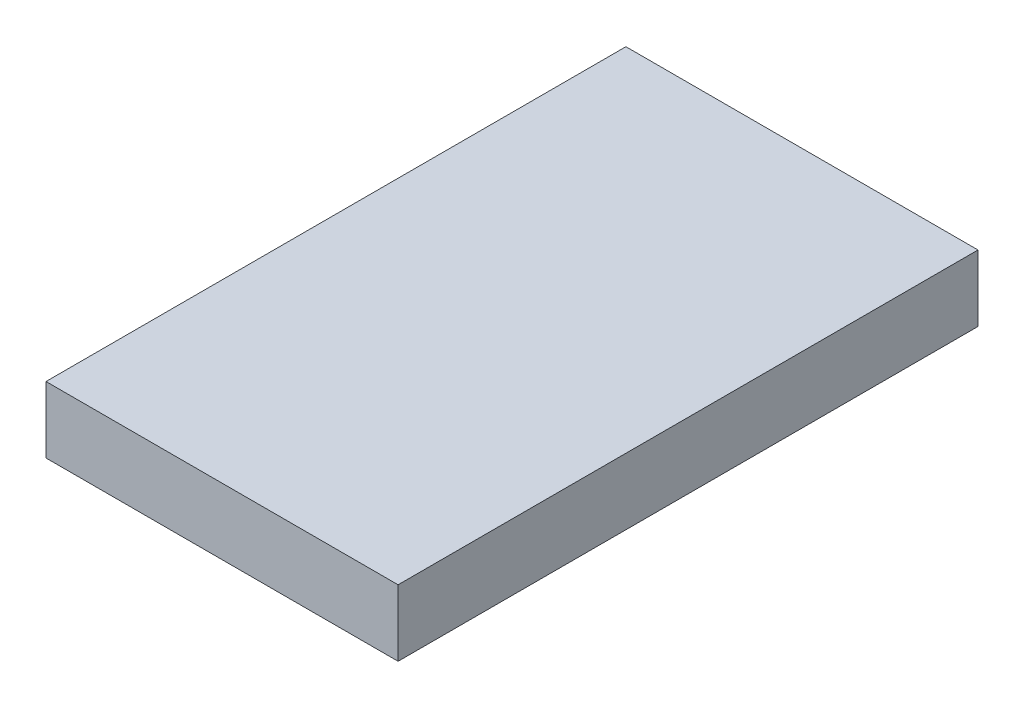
SolidWorks part; units mm, degrees
ref_plane "前视基准面" through (0, 0, 0) normal (0, 0, 1) x (1, 0, 0)
ref_plane "上视基准面" through (0, 0, 0) normal (0, 1, 0) x (1, 0, 0)
ref_plane "右视基准面" through (0, 0, 0) normal (1, 0, 0) x (0, 0, -1)
sketch "草图1" plane through (0, 0, 0) normal (0, 0, 1) x (1, 0, 0)
  line L0 (0, 0) -> (0, 16)
  line L1 (0, 16) -> (-85, 16)
  line L2 (-85, 16) -> (-85, 0)
  line L3 (-85, 0) -> (0, 0)
  dimension "D1" = 85
  dimension "D2" = 16
extrude "凸台-拉伸2" add sketch "草图1" along normal mid plane 140
ref_plane "基准面1" through (-14, 0, 0) normal (1, 0, 0) x (0, 0, -1)
sketch "草图2" plane through (0, 0, 0) normal (0, 0, 1) x (1, 0, 0)
  line L0 (-107.0679, 91) -> (-6.4484, 91) construction
  line L1 (-149, 107) -> (-149, 116)
  line L2 (-149, 116) -> (-144, 116)
  line L3 (-144, 116) -> (-144, 118.5)
  line L4 (-144, 118.5) -> (-126, 118.5)
  line L5 (-126, 118.5) -> (-126, 126)
  line L6 (-126, 126) -> (-14, 126)
  line L7 (-14, -8.8) -> (-14, 8.8) construction
  line L8 (-14, 126) -> (-14, 121)
  line L9 (-34, 116) -> (-114, 116)
  line L10 (-114, 116) -> (-114, 107)
  line L11 (-114, 107) -> (-149, 107)
  line L13 (-34, 116) -> (-34, 121)
  line L14 (-34, 121) -> (-14, 121)
  dimension "D1" = 35
  dimension "D2" = 30
  dimension "D3" = 25
  dimension "D4" = 18
  dimension "D5" = 112
  dimension "D6" = 135
  dimension "D7" = 20
  dimension "D8" = 80
  dimension "D9" = 16
  dimension "D10" = 75
  dimension "D11" = 25
  dimension "D12" = 27.5
